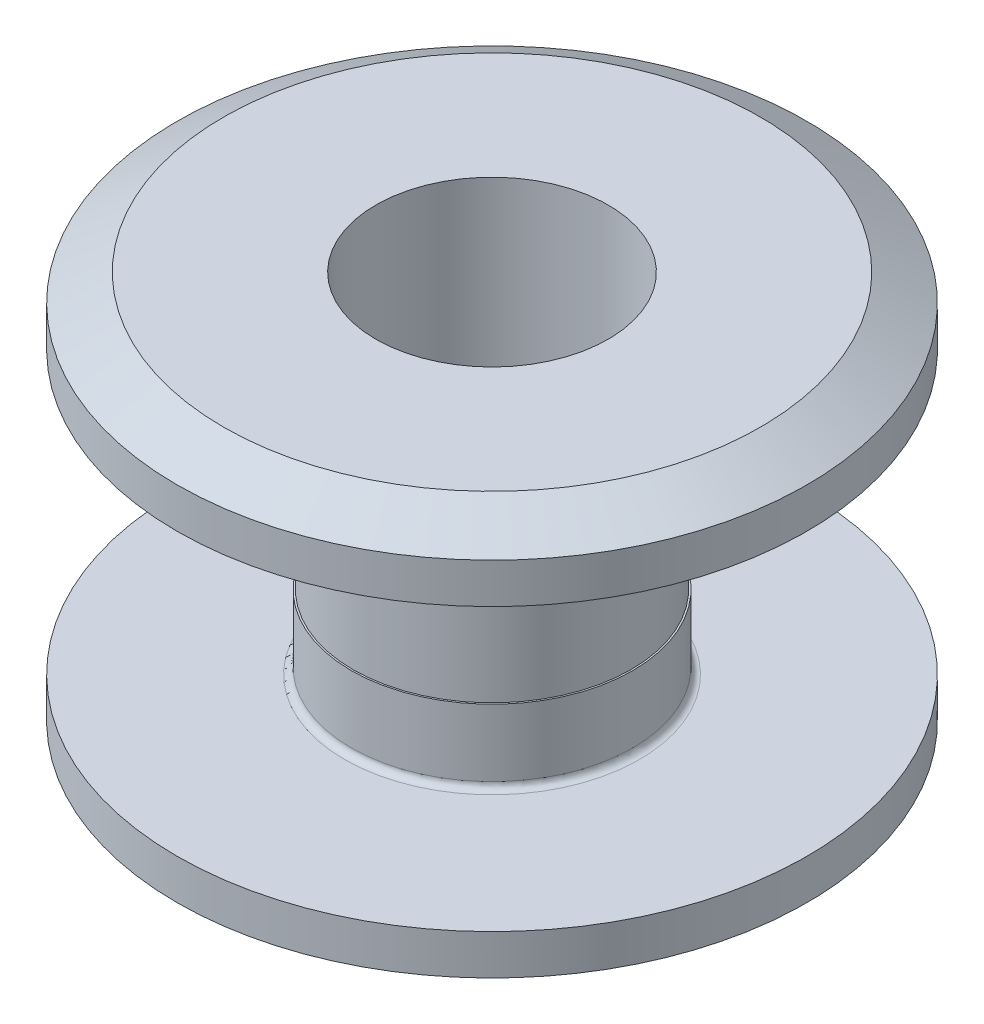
SolidWorks part; units mm, degrees
ref_plane "Plan de face" through (0, 0, 0) normal (0, 0, 1) x (1, 0, 0)
ref_plane "Plan de dessus" through (0, 0, 0) normal (0, 1, 0) x (1, 0, 0)
ref_plane "Plan de droite" through (0, 0, 0) normal (1, 0, 0) x (0, 0, -1)
sketch "Esquisse1" plane through (0, 0, 0) normal (0, 0, 1) x (1, 0, 0)
  line L0 (0, 99.3334) -> (0, -94.0568) construction
  line L1 (0, 0) -> (-47, 0)
  line L2 (-47, 0) -> (-47, 10)
  line L3 (-47, 10) -> (-21, 10)
  line L4 (-21, 10) -> (-21, 21)
  line L5 (-21, 21) -> (-20.75, 21)
  line L6 (-20.75, 21) -> (-20.75, 41)
  line L7 (-20.75, 41) -> (-21, 41)
  line L8 (-21, 41) -> (-21, 52)
  line L9 (-21, 52) -> (-47, 52)
  line L10 (-47, 52) -> (-47, 62)
  line L11 (-47, 62) -> (0, 62)
  line L12 (0, 62) -> (0, 0)
  dimension "D1" = 94
  dimension "D2" = 10
  dimension "D3" = 41.5
  dimension "D4" = 20
  dimension "D5" = 42
  dimension "D6" = 11
  dimension "D8" = 42
  dimension "D10" = 62
revolve "Révolution1" add sketch "Esquisse1" angle 360 about L0
chamfer "Chanfrein1" distance 4 angle 60 2 edges at (0, 62, 47) (0, 0, 47)
fillet "Congé2" radius 1 2 edges at (0, 10, 21) (0, 52, 21)
sketch "Esquisse2" plane through (0, 0, 0) normal (0, 1, 0) x (1, 0, 0)
  circle A0 centre (0, 0) radius 17.35
  dimension "D1" = 34.7
extrude "Enlèv. mat.-Extru.2" cut sketch "Esquisse2" along normal through all
